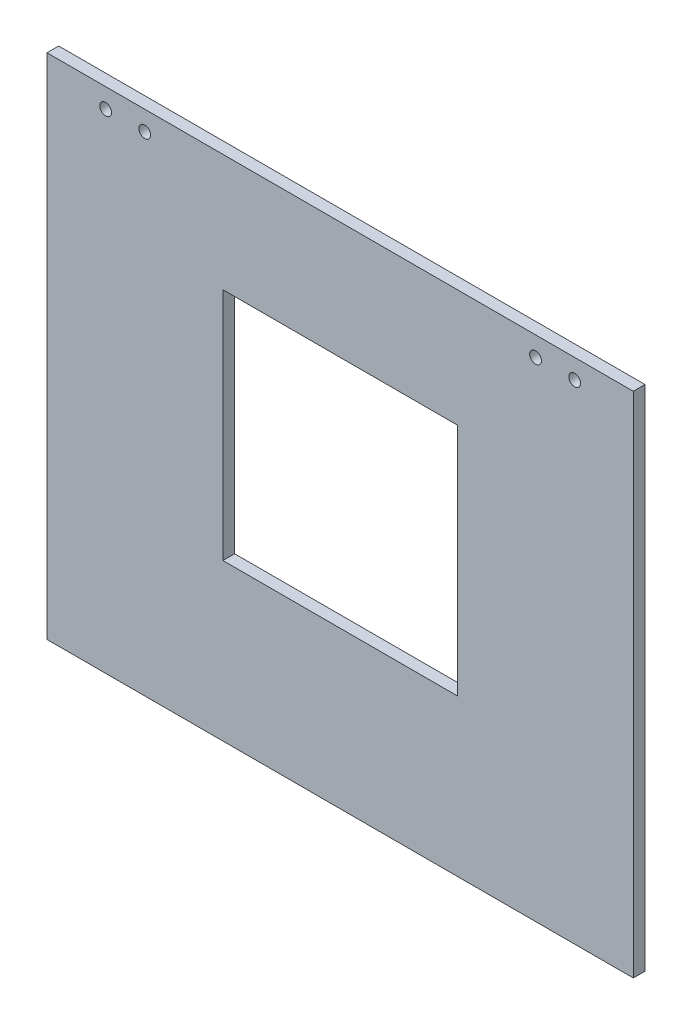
SolidWorks part; units mm, degrees
ref_plane "Plan de face" through (0, 0, 0) normal (0, 0, 1) x (1, 0, 0)
ref_plane "Plan de dessus" through (0, 0, 0) normal (0, 1, 0) x (1, 0, 0)
ref_plane "Plan de droite" through (0, 0, 0) normal (1, 0, 0) x (0, 0, -1)
sketch "Esquisse1" plane through (0, 0, 0) normal (0, 0, 1) x (1, 0, 0)
  line L0 (75, 170) -> (75, -30) construction
  line L1 (0, 0) -> (150, 0)
  line L2 (0, 0) -> (0, 130)
  line L3 (0, 130) -> (150, 130)
  line L4 (150, 0) -> (150, 130)
  line L5 (45, 100) -> (105, 100)
  line L6 (45, 100) -> (45, 40)
  line L7 (45, 40) -> (105, 40)
  line L8 (105, 100) -> (105, 40)
  circle A0 centre (15, 125) radius 1.5
  circle A1 centre (135, 125) radius 1.5
  circle A2 centre (25, 125) radius 1.5
  circle A3 centre (125, 125) radius 1.5
  dimension "D8" = 3
  dimension "D11" = 30
  dimension "D1" = 150
  dimension "D2" = 130
  dimension "D3" = 75
  dimension "D4" = 60
  dimension "D5" = 30
  dimension "D6" = 5
  dimension "D7" = 60
  dimension "D9" = 50
  dimension "D10" = 5
extrude "Extrusion1" add sketch "Esquisse1" along normal blind 3
